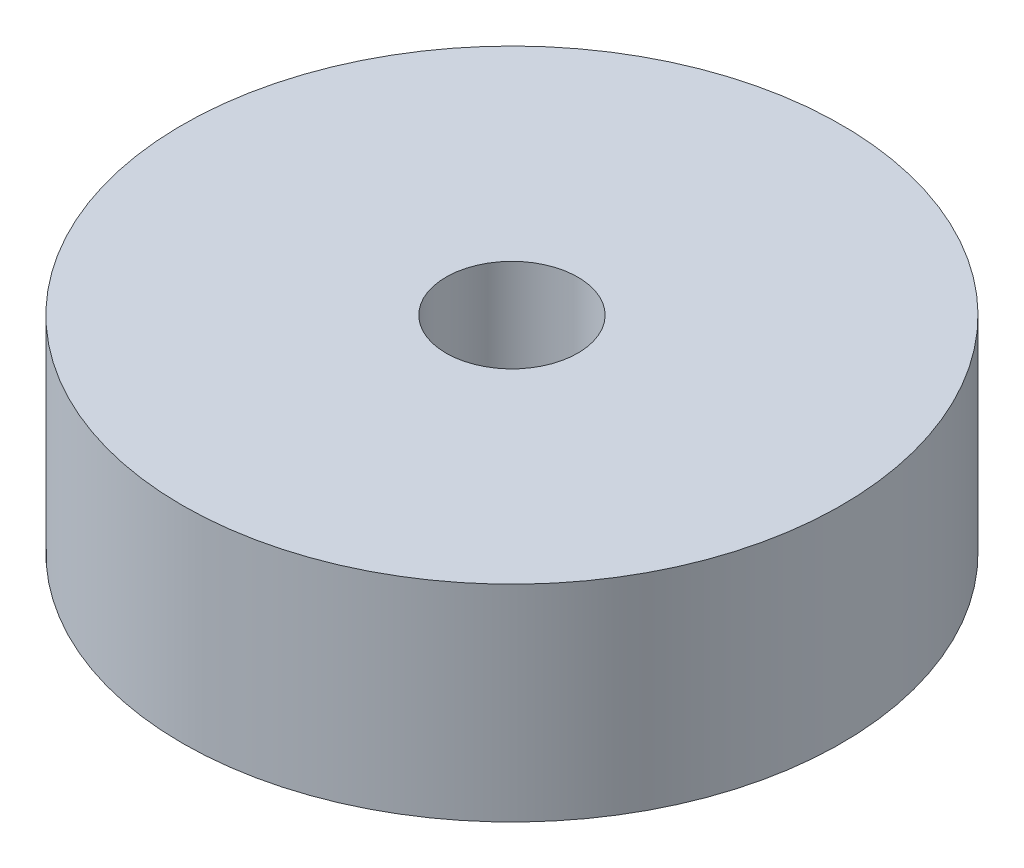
SolidWorks part; units mm, degrees
ref_plane "Front Plane" through (0, 0, 0) normal (0, 0, 1) x (1, 0, 0)
ref_plane "Top Plane" through (0, 0, 0) normal (0, 1, 0) x (1, 0, 0)
ref_plane "Right Plane" through (0, 0, 0) normal (1, 0, 0) x (0, 0, -1)
sketch "Sketch1" plane through (0, 0, 0) normal (0, 1, 0) x (1, 0, 0)
  circle A0 centre (0, 0) radius 8
  circle A1 centre (0, 0) radius 1.6
  dimension "D1" = 16
  dimension "D2" = 3.2
extrude "Boss-Extrude1" add sketch "Sketch1" along normal blind 5
